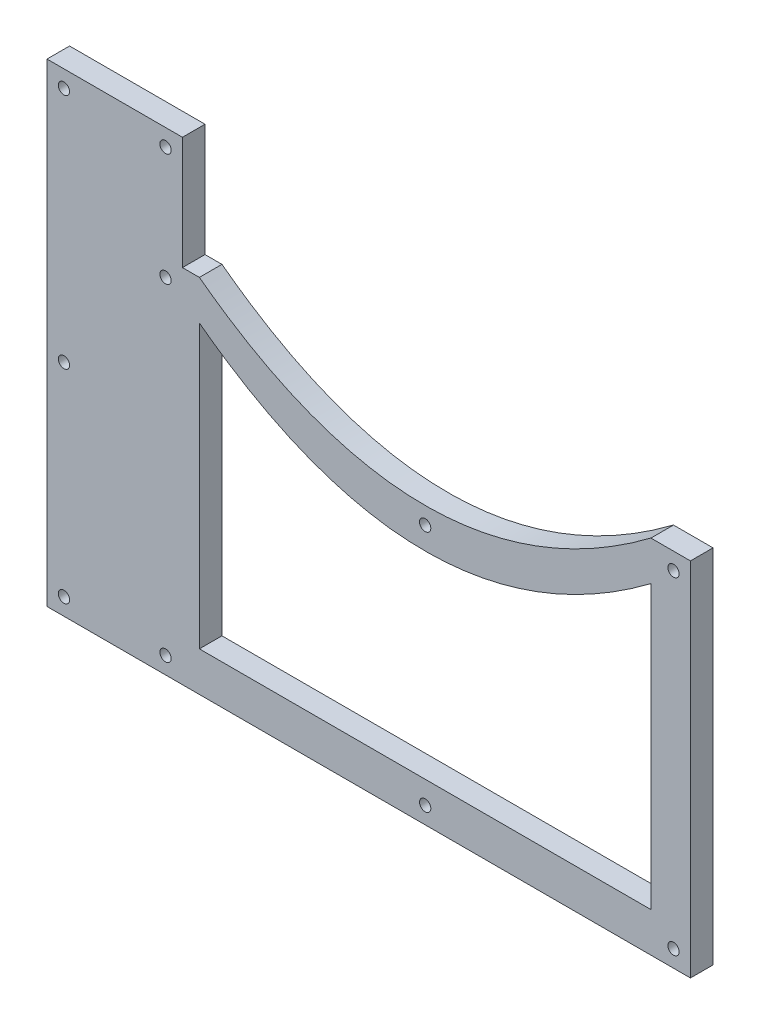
SolidWorks part; units mm, degrees
ref_plane "前视基准面" through (0, 0, 0) normal (0, 0, 1) x (1, 0, 0)
ref_plane "上视基准面" through (0, 0, 0) normal (0, 1, 0) x (1, 0, 0)
ref_plane "右视基准面" through (0, 0, 0) normal (1, 0, 0) x (0, 0, -1)
sketch "草图1" plane through (0, 0, 0) normal (0, 0, 1) x (1, 0, 0)
  line L0 (0, 96.0851) -> (0, -90.3293) construction
  line L1 (-166.3618, 0) -> (192.1701, 0) construction
  line L2 (24, 64) -> (27, 64)
  line L3 (27, 64) -> (107, 64) construction
  line L4 (67, 64) -> (67, -25.0099) construction
  line L7 (107, 7) -> (107, 57)
  line L8 (24, 64) -> (24, 84)
  line L9 (24, 84) -> (0, 84)
  line L10 (0, 84) -> (0, 0)
  line L11 (0, 0) -> (114, 0)
  line L12 (114, 0) -> (114, 64)
  line L13 (114, 64) -> (107, 64)
  line L17 (3, 152.7734) -> (3, -31.6894) construction
  line L18 (-14.5627, 3) -> (149.1315, 3) construction
  line L19 (-19.094, 81) -> (36.6036, 81) construction
  line L20 (111, 79.7057) -> (111, -31.6894) construction
  line L21 (21, 142.7084) -> (21, -39.7452) construction
  line L22 (27, 57) -> (27, 7)
  line L23 (27, 7) -> (107, 7)
  circle A0 centre (3, 81) radius 1
  circle A1 centre (21, 81) radius 1
  circle A2 centre (21, 61) radius 1
  circle A3 centre (3, 39) radius 1
  circle A4 centre (3, 3) radius 1
  circle A5 centre (21, 3) radius 1
  circle A6 centre (67, 3) radius 1
  circle A7 centre (111, 3) radius 1
  circle A8 centre (111, 61) radius 1
  circle A9 centre (67, 46) radius 1
  spline S0 degree 2 poles (27, 64) (67, 34) (107, 64) knots 0 0 0 1 1 1
  spline S1 degree 2 poles (27, 57) (67, 27) (107, 57) knots 0 0 0 1 1 1
  point P9 (27, 64)
  dimension "D2" = 84
  dimension "D8" = 80
  dimension "D20" = 2
  dimension "D21" = 2
  dimension "D22" = 2
  dimension "D23" = 2
  dimension "D24" = 2
  dimension "D25" = 2
  dimension "D26" = 2
  dimension "D27" = 2
  dimension "D28" = 2
  dimension "D29" = 2
  dimension "D1" = 24
  dimension "D3" = 64
  dimension "D4" = 114
  dimension "D5" = 3
  dimension "D6" = 7
  dimension "D7" = 15
  dimension "D9" = 7
  dimension "D13" = 7
  dimension "D14" = 15
  dimension "D15" = 3
  dimension "D16" = 3
  dimension "D17" = 3
  dimension "D18" = 3
  dimension "D19" = 3
  dimension "D30" = 20
  dimension "D31" = 15
  dimension "D32" = 42
extrude "凸台-拉伸2" add sketch "草图1" along normal blind 4
